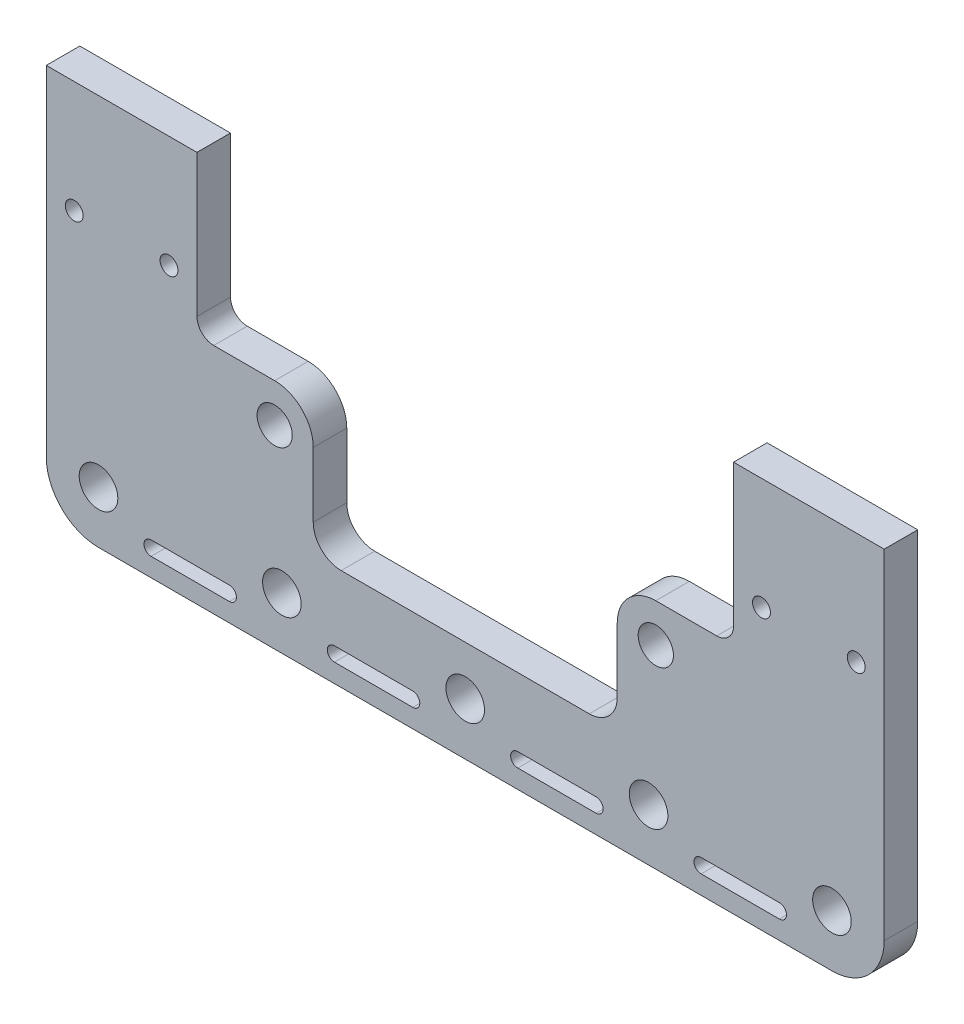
SolidWorks part; units mm, degrees
ref_plane "Front Plane" through (0, 0, 0) normal (0, 0, 1) x (1, 0, 0)
ref_plane "Top Plane" through (0, 0, 0) normal (0, 1, 0) x (1, 0, 0)
ref_plane "Right Plane" through (0, 0, 0) normal (1, 0, 0) x (0, 0, -1)
sketch "Model" plane through (0, 0, 0) normal (0, 0, 1) x (1, 0, 0)
  line L0 (198.0554, 367.8756) -> (198.0554, 147.7838) construction
  line L1 (272.9904, 270.7172) -> (272.9904, 210.0622)
  line L2 (170.8703, 235.402) -> (170.8703, 223.837)
  line L3 (175.8703, 218.837) -> (220.2405, 218.837)
  line L4 (132.4654, 200.7172) -> (263.6454, 200.7172)
  line L5 (163.9703, 242.302) -> (153.0704, 242.302)
  line L6 (150.0704, 245.302) -> (150.0704, 270.7172)
  line L7 (150.0704, 270.7172) -> (123.1204, 270.7172)
  line L8 (163.9703, 235.402) -> (170.8703, 235.402) construction
  line L9 (246.0404, 245.302) -> (246.0404, 270.7172)
  line L10 (246.0404, 270.7172) -> (272.9904, 270.7172)
  line L11 (225.2405, 235.402) -> (225.2405, 223.837)
  line L12 (232.1405, 242.302) -> (243.0404, 242.302)
  line L13 (132.4654, 210.0622) -> (198.0554, 210.0622) construction
  line L14 (198.0554, 210.0622) -> (263.6454, 210.0622) construction
  line L15 (141.8616, 205.318) -> (155.8642, 205.318) construction
  line L16 (141.8616, 206.5889) -> (155.8642, 206.5889)
  line L17 (141.8616, 204.0471) -> (155.8642, 204.0471)
  line L18 (174.6566, 205.318) -> (188.6592, 205.318) construction
  line L19 (174.6566, 206.5889) -> (188.6592, 206.5889)
  line L20 (174.6566, 204.0471) -> (188.6592, 204.0471)
  line L21 (132.4654, 210.0622) -> (141.8616, 205.318) construction
  line L22 (123.1204, 270.7172) -> (123.1204, 210.0622)
  line L23 (155.8642, 205.318) -> (165.2604, 210.0622) construction
  line L24 (165.2604, 210.0622) -> (174.6566, 205.318) construction
  line L25 (188.6592, 205.318) -> (198.0554, 210.0622) construction
  line L26 (221.4542, 205.318) -> (207.4516, 205.318) construction
  line L27 (221.4542, 206.5889) -> (207.4516, 206.5889)
  line L28 (-7.4087, 367.7867) -> (403.5195, 367.7867) construction
  line L29 (221.4542, 204.0471) -> (207.4516, 204.0471)
  line L30 (254.2493, 205.318) -> (240.2466, 205.318) construction
  line L31 (254.2493, 206.5889) -> (240.2466, 206.5889)
  line L32 (254.2493, 204.0471) -> (240.2466, 204.0471)
  arc A0 (123.1204, 210.0622) -> (132.4654, 200.7172) centre (132.4654, 210.0622) ccw
  arc A1 (175.8703, 218.837) -> (170.8703, 223.837) centre (175.8703, 223.837) cw
  arc A2 (170.8703, 235.402) -> (163.9703, 242.302) centre (163.9703, 235.402) ccw
  arc A3 (153.0704, 242.302) -> (150.0704, 245.302) centre (153.0704, 245.302) cw
  circle A4 centre (163.9703, 235.402) radius 3.15
  circle A5 centre (232.1405, 235.402) radius 3.15
  arc A6 (243.0404, 242.302) -> (246.0404, 245.302) centre (243.0404, 245.302) ccw
  arc A7 (272.9904, 210.0622) -> (263.6454, 200.7172) centre (263.6454, 210.0622) cw
  arc A8 (220.2405, 218.837) -> (225.2405, 223.837) centre (220.2405, 223.837) ccw
  arc A9 (225.2405, 235.402) -> (232.1405, 242.302) centre (232.1405, 235.402) cw
  circle A10 centre (128.1204, 250.7172) radius 1.6
  circle A11 centre (145.0704, 250.7172) radius 1.6
  circle A12 centre (251.0404, 250.7172) radius 1.6
  circle A13 centre (267.9904, 250.7172) radius 1.6
  circle A14 centre (132.4654, 210.0622) radius 3.4521
  circle A15 centre (263.6454, 210.0622) radius 3.4521
  circle A16 centre (198.0554, 210.0622) radius 3.4521
  circle A17 centre (165.2604, 210.0622) radius 3.4521
  circle A18 centre (230.8504, 210.0622) radius 3.4521
  arc A19 (141.8616, 206.5889) -> (141.8616, 204.0471) centre (141.8616, 205.318) ccw
  arc A20 (155.8642, 204.0471) -> (155.8642, 206.5889) centre (155.8642, 205.318) ccw
  arc A21 (174.6566, 206.5889) -> (174.6566, 204.0471) centre (174.6566, 205.318) ccw
  arc A22 (188.6592, 204.0471) -> (188.6592, 206.5889) centre (188.6592, 205.318) ccw
  arc A23 (221.4542, 206.5889) -> (221.4542, 204.0471) centre (221.4542, 205.318) cw
  arc A24 (207.4516, 204.0471) -> (207.4516, 206.5889) centre (207.4516, 205.318) cw
  arc A25 (254.2493, 206.5889) -> (254.2493, 204.0471) centre (254.2493, 205.318) cw
  arc A26 (240.2466, 204.0471) -> (240.2466, 206.5889) centre (240.2466, 205.318) cw
  point P28 (198.0554, 200.7172)
  point P29 (198.0554, 218.837)
  point P51 (148.8629, 205.318)
  point P58 (181.6579, 205.318)
  point P71 (214.4529, 205.318)
  point P78 (247.2479, 205.318)
  dimension "D10" = 20
  dimension "D11" = 5
  dimension "D2" = 5
  dimension "D3" = 26.95
  dimension "D13" = 70
  dimension "D5" = 6.3
  dimension "D7" = 3
  dimension "D4" = 68.1703
  dimension "D6" = 6.9
  dimension "D12" = 3.2
  dimension "D1" = 149.87
  dimension "D8" = 5
  dimension "D9" = 20
extrude "Boss-Extrude1" add sketch "Model" along normal blind 6
